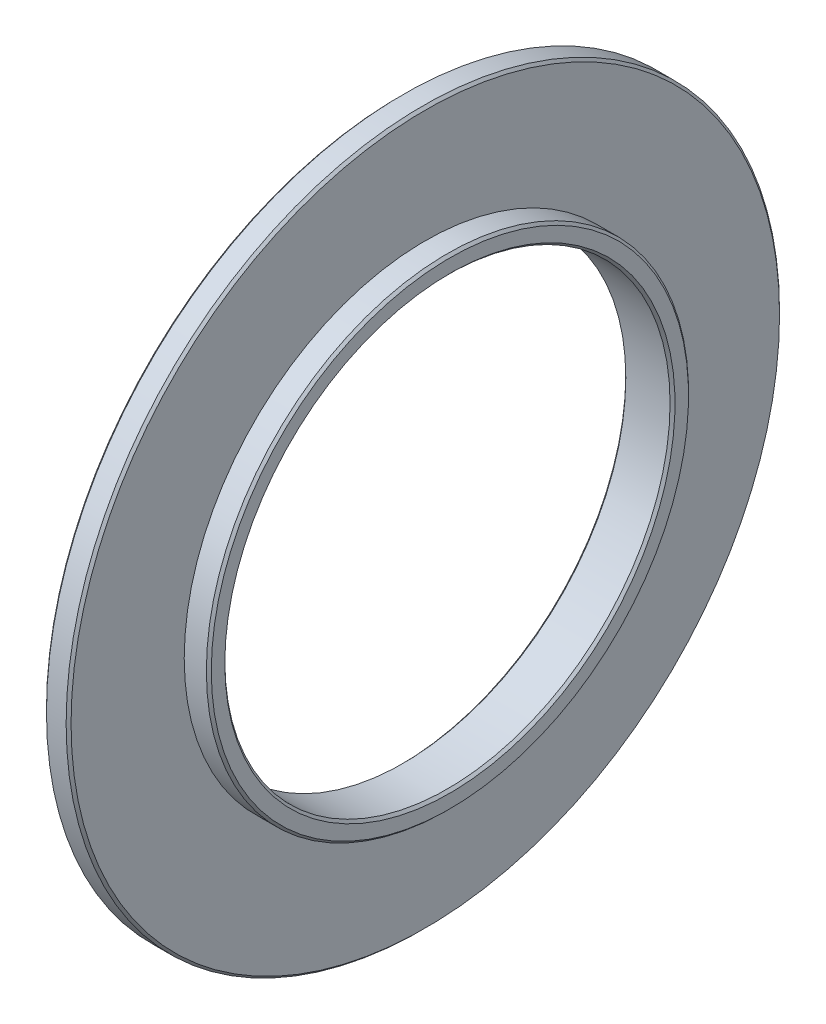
SolidWorks part; units mm, degrees
ref_plane "Plan de face" through (0, 0, 0) normal (0, 0, 1) x (1, 0, 0)
ref_plane "Plan de dessus" through (0, 0, 0) normal (0, 1, 0) x (1, 0, 0)
ref_plane "Plan de droite" through (0, 0, 0) normal (1, 0, 0) x (0, 0, -1)
sketch "Esquisse1" plane through (0, 0, 0) normal (0, 0, 1) x (1, 0, 0)
  line L0 (0, 0) -> (44.1379, 0) construction
  line L1 (0, 72.5) -> (0, 45.25)
  line L2 (0, 45.25) -> (10, 45.25)
  line L3 (10, 45.25) -> (10, 49)
  line L4 (10, 49) -> (5, 49)
  line L5 (5, 49) -> (5, 72.5)
  line L6 (5, 72.5) -> (0, 72.5)
  dimension "D1" = 145
  dimension "D2" = 90.5
  dimension "D3" = 98
  dimension "D4" = 5
  dimension "D5" = 5
revolve "Révolution1" add sketch "Esquisse1" angle 360 about L0
chamfer "Chanfrein1" distance 0.5 angle 45 5 edges at (0, 0, 45.25) (0, 0, 72.5) (10, 0, 45.25) (10, 0, 49) (5, 0, 72.5)
